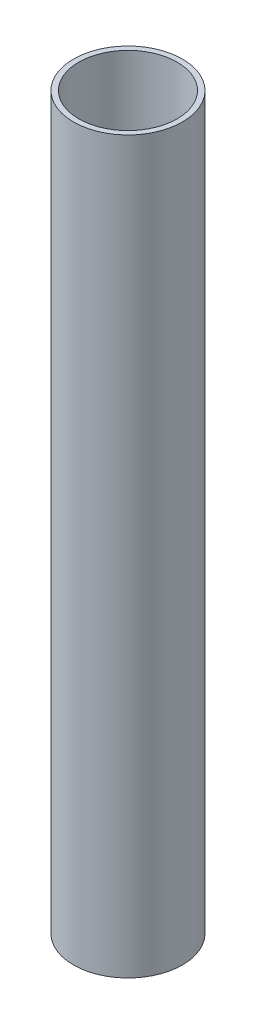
SolidWorks part; units mm, degrees
ref_plane "Front Plane" through (0, 0, 0) normal (0, 0, 1) x (1, 0, 0)
ref_plane "Top Plane" through (0, 0, 0) normal (0, 1, 0) x (1, 0, 0)
ref_plane "Right Plane" through (0, 0, 0) normal (1, 0, 0) x (0, 0, -1)
sketch "Sketch1" plane through (0, 0, 0) normal (0, 1, 0) x (1, 0, 0)
  circle A0 centre (0, 0) radius 16.1163
  dimension "D1" = 32.2326
extrude "Extrude-Thin1" add sketch "Sketch1" along normal blind 215.9 thin
